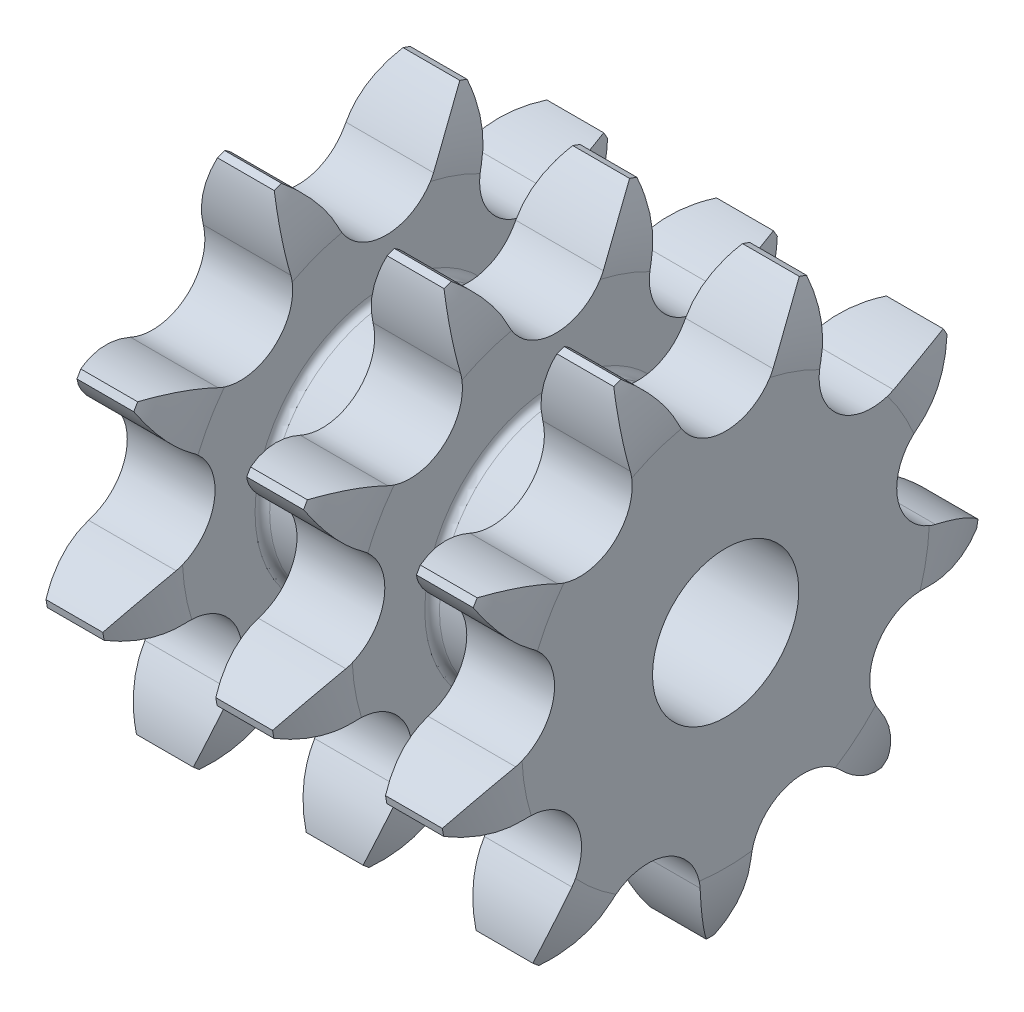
SolidWorks part; units mm, degrees
ref_plane "Plane1" through (0, 0, 0) normal (0, 0, 1) x (1, 0, 0)
ref_plane "Plane2" through (0, 0, 0) normal (0, 1, 0) x (1, 0, 0)
ref_plane "Plane3" through (0, 0, 0) normal (1, 0, 0) x (0, 0, -1)
sketch "Clipboard" plane through (0, 0, 0) normal (0, 1, 0) x (1, 0, 0)
  line L0 (0, 0) -> (12.5436, -1.9867)
  line L1 (-15, 0) -> (100, 0) construction
  line L2 (0, 0) -> (-0.8416, 0.9512)
  line L3 (0, 0) -> (-11.863, 4.5341)
  line L4 (0, 0) -> (3.0618, 0.4849)
  line L5 (0, 0) -> (-2.8109, -1.0484)
  line L6 (0, 0) -> (-29.0469, -19.598)
  line L7 (-0.8416, 0.9512) -> (35.5852, 8.6939)
  line L8 (-76.2, 38.1) -> (-75.2, 38.1)
  line L9 (-73.4259, 41.6592) -> (-72.8306, 41.7344)
  line L10 (-73.4741, 12.7512) -> (-59.5541, 12.7512)
  circle A0 centre (0, 0) radius 4.255
  circle A1 centre (0, 0) radius 10.1515
  circle A2 centre (0, 0) radius 25
sketch "BasProSke" plane through (0, 0, 0) normal (0, 1, 0) x (1, 0, 0)
  line L0 (-10, 0) -> (60, 0) construction
  line L1 (0, 0) -> (0, 16.7129)
  line L2 (0, 0) -> (35.04, 0)
  line L3 (35.04, 0) -> (35.04, 16.7129)
  line L4 (33.77, 22.2487) -> (1.27, 22.2487)
  arc A0 (0, 16.7129) -> (1.27, 22.2487) centre (12.7, 16.7129) cw
  arc A1 (35.04, 16.7129) -> (33.77, 22.2487) centre (22.34, 16.7129) ccw
revolve "Base-Revolve" add sketch "BasProSke" angle 360 about L0
sketch "GrvSke" plane through (0, 0, 0) normal (0, 1, 0) x (1, 0, 0)
  line L0 (7.2, 16.7129) -> (7.2, 10.7515)
  line L1 (7.8, 10.1515) -> (13.32, 10.1515)
  line L2 (13.92, 10.7515) -> (13.92, 16.7129)
  line L3 (5.93, 22.2487) -> (15.19, 22.2487)
  line L4 (10.56, 0) -> (10.56, 52.07) construction
  line L5 (-10, 0) -> (60, 0) construction
  line L6 (0, 0) -> (35.56, 0) construction
  arc A0 (13.92, 16.7129) -> (15.19, 22.2487) centre (26.62, 16.7129) cw
  arc A1 (7.2, 16.7129) -> (5.93, 22.2487) centre (-5.5, 16.7129) ccw
  arc A2 (7.2, 10.7515) -> (7.8, 10.1515) centre (7.8, 10.7515) ccw
  arc A3 (13.32, 10.1515) -> (13.92, 10.7515) centre (13.32, 10.7515) ccw
revolve "Groove" cut sketch "GrvSke" angle 360 about L6
pattern_linear "Grooves" count 2 spacing 13.92 along (1, 0, 0) of "Groove"
sketch "TooCutSke" plane through (0, 0, 0) normal (1, 0, 0) x (0, 0, -1)
  line L0 (0, 18.6087) -> (3.8949, 16.7925) construction
  line L1 (0, 0) -> (0, 107) construction
  line L2 (0, 18.6087) -> (-10, 18.6087) construction
  line L3 (0, 18.6087) -> (-3.8949, 16.7925) construction
  arc A0 (3.8949, 16.7925) -> (7.8075, 21.3669) centre (14.0756, 12.0451) cw
  arc A1 (3.8949, 16.7925) -> (-3.8949, 16.7925) centre (0, 18.6087) cw
  arc A2 (-3.8949, 16.7925) -> (-7.8075, 21.3669) centre (-14.0756, 12.0451) ccw
  arc A3 (7.8075, 21.3669) -> (-7.8075, 21.3669) centre (0, 0) ccw
extrude "ToothCut" cut sketch "TooCutSke" along normal through all
pattern_circular "TeethCuts" count 9 every 40 about axis through (-10, 0, 0) along (1, 0, 0) of "ToothCut"
sketch "HubNeaOneSke" plane through (0, 0, 0) normal (-1, 0, 0) x (0, 0, 1)
  circle A0 centre (0, 0) radius 10.1515
extrude "HubNearOne" [suppressed] add sketch "HubNeaOneSke" along normal blind 2.2005
fillet "HubNearOneFillet" [suppressed] radius 0.6
sketch "HubNeaBotSke" plane through (0, 0, 0) normal (-1, 0, 0) x (0, 0, 1)
  circle A0 centre (0, 0) radius 10.1515
extrude "HubNearBoth" [suppressed] add sketch "HubNeaBotSke" along normal blind 1.1003
fillet "HubNearBothFillet" [suppressed] radius 0.6
ref_plane "FarPln" through (35.04, 0, 0) normal (1, 0, 0) x (0, 0, -1)
sketch "HubFarSke" plane through (35.04, 0, 0) normal (1, 0, 0) x (0, 0, -1)
  circle A0 centre (0, 0) radius 10.1515
extrude "HubFar" [suppressed] add sketch "HubFarSke" along normal blind 1.1003
fillet "HubFarFillet" [suppressed] radius 0.6
sketch "BorSke" plane through (0, 0, 0) normal (1, 0, 0) x (0, 0, -1)
  circle A0 centre (0, 0) radius 6
extrude "Bore" cut sketch "BorSke" along normal mid plane 74.481
sketch "KeySke" plane through (0, 0, 0) normal (1, 0, 0) x (0, 0, -1)
  line L0 (-1, 0) -> (-1, 7)
  line L1 (-1, 7) -> (1, 7)
  line L2 (1, 7) -> (1, 0)
  line L3 (0, 0) -> (0, 34) construction
  line L4 (-1, 0) -> (1, 0)
extrude "Keyway" [suppressed] cut sketch "KeySke" along normal mid plane 74.481
pattern_circular "Keyway2" [suppressed] count 2 every 90 about axis through (-10, 0, 0) along (1, 0, 0)
equation "' \"Pitch@Clipboard\" = 12.7"
equation "' \"Num_strands@Clipboard\" = 3"
equation "' \"Num_teeth@Clipboard\" = 9"
equation "' \"Hub_dia@Clipboard\" = 50"
equation "' \"Overall_len@Clipboard\" = 3"
equation "' \"Diameter@BorSke\" = 12"
equation "' \"T_dim@Clipboard\" = 1"
equation "' \"Width@KeySke\" = 2"
equation "' \"Dr@Clipboard\" = 8.51"
equation "' \"Face_width@Clipboard\" = 7.2"
equation "' \"Side_radius@Clipboard\" = 12.7"
equation "' \"Side_relief@Clipboard\" = 1.27"
equation "' \"Transv_pitch@Clipboard\" = 13.92"
equation "' \"Show_teeth@Clipboard\" = 9"
equation "' \"Fillet_rad@Clipboard\" = 0.6"
equation "' \"Plate_wid@Clipboard\" = 11.8"
equation "\"Num_teeth@Clipboard\" = int( \"Num_teeth@Clipboard\" )"
equation "\"Num_teeth@Clipboard\" = ((sgn( \"Num_teeth@Clipboard\" - 5.0)+1)*( \"Num_teeth@Clipboard\" - 5.0))/2 +5.0"
equation "\"Num_teeth@Clipboard\" = ((sgn( \"Num_teeth@Clipboard\" - 200.0)-1)*( \"Num_teeth@Clipboard\" - 200.0))/-2 +200.0"
equation "\"MHD@Clipboard\" = \"Pitch@Clipboard\" * (1.0 / tan(3.14159265 / \"Num_teeth@Clipboard\" )) - 1.05 * \"Plate_wid@Clipboard\" - 2.0 * \"Fillet_rad@Clipboard\" - 1.0"
equation "\"Thickness@Clipboard\"  = \"Face_width@Clipboard\" + (\"Num_strands@Clipboard\" - 1) * \"Transv_pitch@Clipboard\""
equation "\"OAL@Clipboard\" = \"Thickness@Clipboard\" + 2 * \"Fillet_rad@Clipboard\" + 1"
equation "\"MHD@Clipboard\" = ((sgn( \"MHD@Clipboard\" - \"Hub_dia@Clipboard\" )-1)*( \"MHD@Clipboard\" - \"Hub_dia@Clipboard\" ))/-2+ \"Hub_dia@Clipboard\""
equation "\"OAL@Clipboard\" = ((sgn( \"OAL@Clipboard\" - \"Overall_len@Clipboard\" )+1)*( \"OAL@Clipboard\" - \"Overall_len@Clipboard\" ))/2 + \"Overall_len@Clipboard\" + 0.0005"
equation "\"Num_teeth@TeethCuts\" = int( \"Show_teeth@Clipboard\" ) + 1"
equation "\"Num_teeth@TeethCuts\" = ((sgn( \"Num_teeth@TeethCuts\" - \"Num_teeth@Clipboard\" )-1)*( \"Num_teeth@TeethCuts\" - \"Num_teeth@Clipboard\" ))/-2+ \"Num_teeth@Clipboard\""
equation "\"Num_teeth@TeethCuts\" = ((sgn( \"Num_teeth@TeethCuts\" - 2.0)+1)*( \"Num_teeth@TeethCuts\" - 2.0))/2 +2.0"
equation "\"Angle@TeethCuts\" = 360.0 / \"Num_teeth@Clipboard\""
equation "\"Seat_radius@TooCutSke\" = ( \"Pitch@Clipboard\" / 2.0) / sin(3.14159265 / \"Num_teeth@Clipboard\" ) - \"Dr@Clipboard\" / 2.0 + \"Dr@Clipboard\" * 0.505"
equation "\"R1@TooCutSke\"  = \"Dr@Clipboard\" * 0.505"
equation "\"X@TooCutSke\" = 140.0 - (90.0 / \"Num_teeth@Clipboard\")"
equation "\"R2@TooCutSke\" = 0.12 * \"Dr@Clipboard\" * ( \"Num_teeth@Clipboard\" + 2.0)"
equation "\"Overcut@TooCutSke\" = 0.5 + 0.625 * \"Pitch@Clipboard\" - 0.5 * \"Dr@Clipboard\"  +  \"Pitch@Clipboard\" / 2.0 / sin(3.14159265 / \"Num_teeth@Clipboard\" )"
equation "\"Diameter@BasProSke\" = 2.0 * ( 0.625 * \"Pitch@Clipboard\" - 0.5 * \"Dr@Clipboard\"  +  \"Pitch@Clipboard\" / 2.0 / sin(3.14159265 / \"Num_teeth@Clipboard\" ))"
equation "\"Thickness@BasProSke\"  = \"Thickness@Clipboard\""
equation "\"G1@BasProSke\" =  \"Side_relief@Clipboard\""
equation "\"G2@BasProSke\" =  \"Side_relief@Clipboard\""
equation "\"D1@BasProSke\" =  \"Side_radius@Clipboard\""
equation "\"Diameter@GrvSke\" = \"Diameter@BasProSke\""
equation "\"G1@GrvSke\" = \"Side_relief@Clipboard\""
equation "\"D1@GrvSke\" = \"Side_radius@Clipboard\""
equation "\"Grv_diam@GrvSke\" =  \"Pitch@Clipboard\" * (1.0 / tan(3.14159265 / \"Num_teeth@Clipboard\" ))- 1.05 * \"Plate_wid@Clipboard\" - 2.0 * \"Fillet_rad@Clipboard\" - 1.0"
equation "\"Grv_width@GrvSke\" =  \"Transv_pitch@Clipboard\" - \"Face_width@Clipboard\""
equation "\"Offset@GrvSke\" = \"Grv_width@GrvSke\" / 2.0 + \"Face_width@Clipboard\""
equation "\"Fillet_rad@GrvSke\" = \"Fillet_rad@Clipboard\""
equation "\"Offset@Grooves\" = \"Transv_pitch@Clipboard\""
equation "\"Num_grvs@Grooves\" = \"Num_strands@Clipboard\""
equation "\"Num_grvs@Grooves\" = \"Num_grvs@Grooves\" - 1 * sgn( \"Num_grvs@Grooves\" -1)"
equation "\"Diameter@HubNeaOneSke\" = \"MHD@Clipboard\""
equation "\"Length@HubNearOne\" = \"OAL@Clipboard\" - \"Thickness@BasProSke\""
equation "\"Diameter@HubNeaBotSke\" = \"MHD@Clipboard\""
equation "\"Length@HubNearBoth\" = ( \"OAL@Clipboard\" - \"Thickness@BasProSke\" ) / 2.0"
equation "\"D1@HubNearOneFillet\" = \"Fillet_rad@Clipboard\""
equation "\"D1@HubNearBothFillet\" = \"Fillet_rad@Clipboard\""
equation "\"Thickness@FarPln\" = \"Thickness@BasProSke\""
equation "\"Diameter@HubFarSke\" = \"MHD@Clipboard\""
equation "\"Length@HubFar\" = ( \"OAL@Clipboard\" - \"Thickness@BasProSke\" ) / 2.0"
equation "\"D1@HubFarFillet\" = \"Fillet_rad@Clipboard\""
equation "\"D1@Bore\" = \"OAL@Clipboard\" * 2.0"
equation "\"D1@Keyway\" = \"OAL@Clipboard\" * 2.0"
equation "\"Offset@KeySke\" = \"T_dim@Clipboard\" + \"Diameter@BorSke\" / 2.0"
